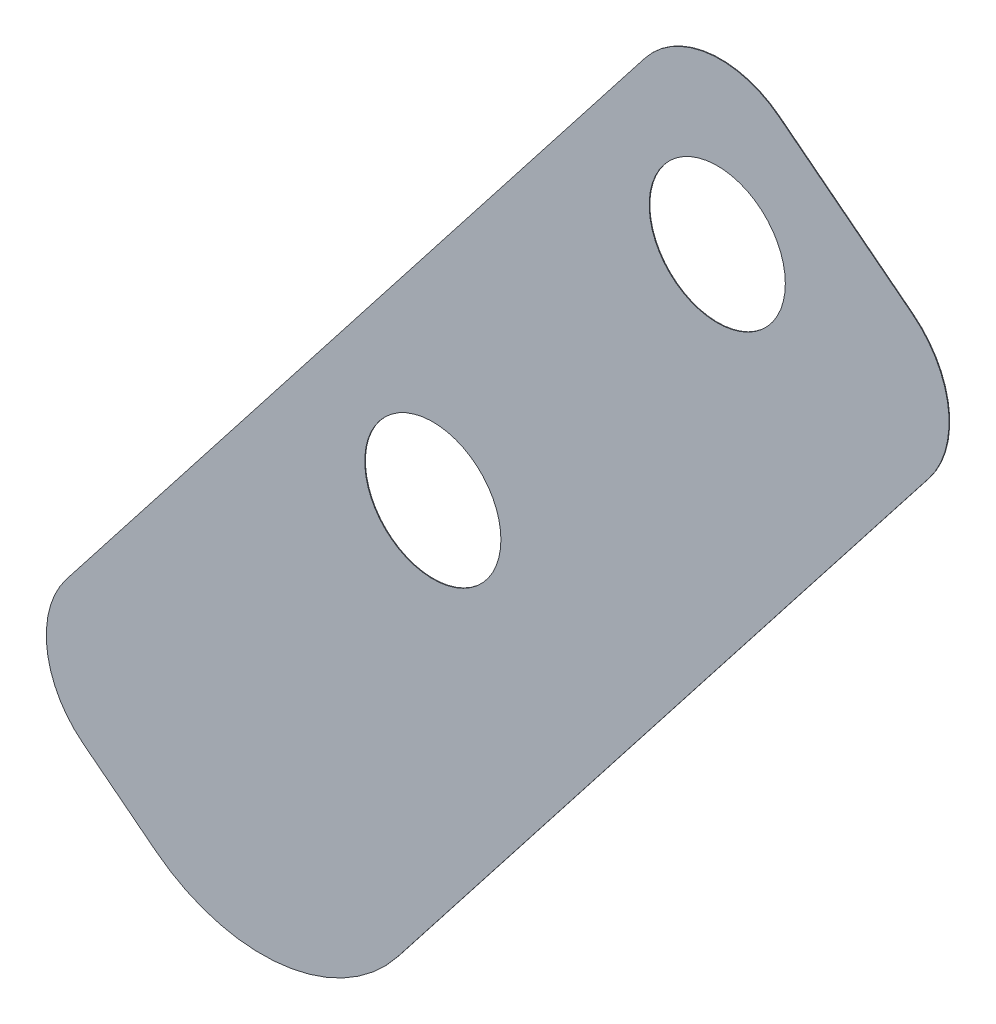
SolidWorks part; units mm, degrees
ref_plane "Front" through (0, 0, 0) normal (0, 0, 1) x (1, 0, 0)
ref_plane "Top" through (0, 0, 0) normal (0, 1, 0) x (1, 0, 0)
ref_plane "Right" through (0, 0, 0) normal (1, 0, 0) x (0, 0, -1)
sketch "Sketch1" plane through (0, 0, 0) normal (0, 0, 1) x (1, 0, 0)
  line L4 (-501.2268, -32.0438) -> (-525.0745, -62.5674)
  line L5 (-511.4107, -69.2136) -> (-489.5178, -41.1919)
  line L6 (-501.2268, -32.0438) -> (-525.0745, -62.5674)
  line L7 (-511.4107, -69.2136) -> (-489.5178, -41.1919)
  line L16 (-490.1963, -35.6657) -> (-495.7006, -31.3653)
  line L17 (-490.1963, -35.6657) -> (-495.7006, -31.3653)
  line L18 (-524.3959, -68.0937) -> (-521.3936, -70.4393)
  line L19 (-524.3959, -68.0937) -> (-521.3936, -70.4393)
  arc A4 (-495.7006, -31.3653) -> (-501.2268, -32.0438) centre (-498.1244, -34.4677) ccw
  arc A5 (-495.7006, -31.3653) -> (-501.2268, -32.0438) centre (-498.1244, -34.4677) ccw
  arc A16 (-489.5178, -41.1919) -> (-490.1963, -35.6657) centre (-492.6202, -38.7681) ccw
  arc A17 (-489.5178, -41.1919) -> (-490.1963, -35.6657) centre (-492.6202, -38.7681) ccw
  arc A18 (-521.3936, -70.4393) -> (-511.4107, -69.2136) centre (-517.015, -64.835) ccw
  arc A19 (-521.3936, -70.4393) -> (-511.4107, -69.2136) centre (-517.015, -64.835) ccw
  arc A20 (-525.0745, -62.5674) -> (-524.3959, -68.0937) centre (-521.9721, -64.9913) ccw
  arc A21 (-525.0745, -62.5674) -> (-524.3959, -68.0937) centre (-521.9721, -64.9913) ccw
  dimension "D1" = 0.508
extrude "Boss-Extrude1" add sketch "Sketch1" along normal blind 0.0254 separate body
hole_wizard "Hole1" positions "Point_Sketch" profile "Profil_Sketch" hole size "Ø0.15" standard "ISO"
sketch "Point_Sketch" plane through (-501.896, -26.5953, 0.0254) normal (0, 0, -1) x (1, 0, 0)
  point P0 (3.6543, 10.6011)
  point P2 (-8.0741, 25.6127)
sketch "Profil_Sketch" plane through (-498.2418, -37.1964, 0.0254) normal (1, 0, 0) x (0, -1, 0)
  line L0 (0, 0) -> (0, 0.0254)
  line L1 (0, 0.0254) -> (2.8067, 0.0254)
  line L2 (2.8067, 0.0254) -> (2.8067, 0)
  line L5 (2.8067, 0) -> (0, 0)
  line L11 (0, -6.35) -> (0, 107.95) construction
  dimension "Diameter" = 5.6134
  dimension "Thru Hole Depth" = 0.0254
other "usin_DL090_10-24x1.75-SHCS<1>"
